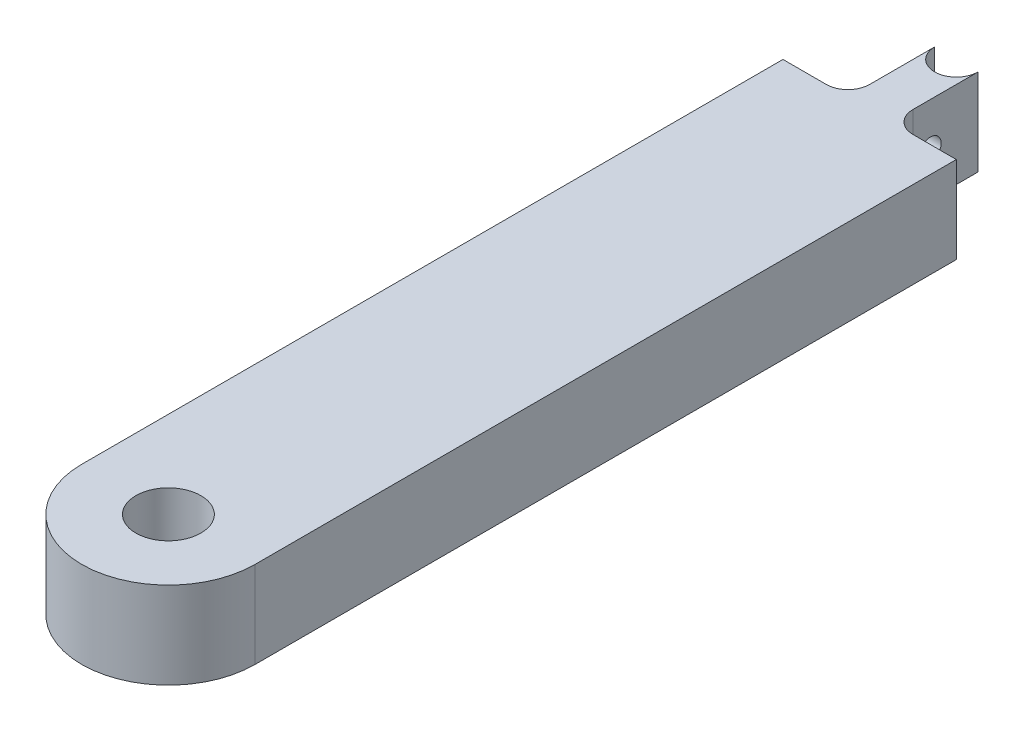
SolidWorks part; units mm, degrees
ref_plane "Front Plane" through (0, 0, 0) normal (0, 0, 1) x (1, 0, 0)
ref_plane "Top Plane" through (0, 0, 0) normal (0, 1, 0) x (1, 0, 0)
ref_plane "Right Plane" through (0, 0, 0) normal (1, 0, 0) x (0, 0, -1)
sketch "Sketch1" plane through (0, 0, 0) normal (0, 1, 0) x (1, 0, 0)
  line L0 (0, 0) -> (0, 230.886) construction
  line L1 (-25.4, 0) -> (-25.4, 230.886)
  line L2 (25.4, 0) -> (25.4, 230.886)
  line L3 (-6.35, 230.886) -> (-6.35, 205.486)
  line L4 (0, 230.886) -> (0, 193.833)
  line L9 (-6.35, 205.486) -> (-25.4, 205.486)
  line L10 (6.35, 230.886) -> (6.35, 205.486)
  line L11 (6.35, 205.486) -> (25.4, 205.486)
  line L13 (-25.4, 215.011) -> (-25.4, 199.136)
  line L15 (25.4, 215.011) -> (25.4, 199.136)
  circle A0 centre (0, 0) radius 6.35
  arc A1 (-25.4, 0) -> (25.4, 0) centre (0, 0) ccw
  arc A2 (25.4, 230.886) -> (-25.4, 230.886) centre (0, 230.886) ccw
  circle A3 centre (0, 230.886) radius 6.35
  point P3 (0, 115.443)
  dimension "D1" = 12.7
  dimension "D2" = 25.4
  dimension "D3" = 230.886
extrude "Boss-Extrude1" add sketch "Sketch1" along normal blind 25.4
fillet "Fillet4" radius 6.35 2 edges at (6.35, 12.7, -205.486) (-6.35, 12.7, -205.486)
sketch "Sketch4" plane through (-6.35, 0, 0) normal (-1, 0, 0) x (0, 0, 1)
  line L0 (0, 0) -> (-205.486, 0) construction
  line L2 (-205.486, 25.4) -> (-205.486, 0) construction
  circle A0 centre (-216.916, 12.7) radius 3.175
  point P3 (-218.186, 12.7)
  point P6 (-253.771, 12.7)
  dimension "D1" = 6.35
  dimension "D2" = 12.7
  dimension "D3" = 11.43
extrude "Cut-Extrude4" cut sketch "Sketch4" against normal blind 64.008
sketch "Sketch5" plane through (0, 0, 0) normal (0, -1, 0) x (1, 0, 0)
  circle A3 centre (0, 0) radius 9.525
  circle A4 centre (0, 0) radius 9.525
  dimension "D1" = 3.175
extrude "Cut-Extrude5" cut sketch "Sketch5" against normal blind 64.008
